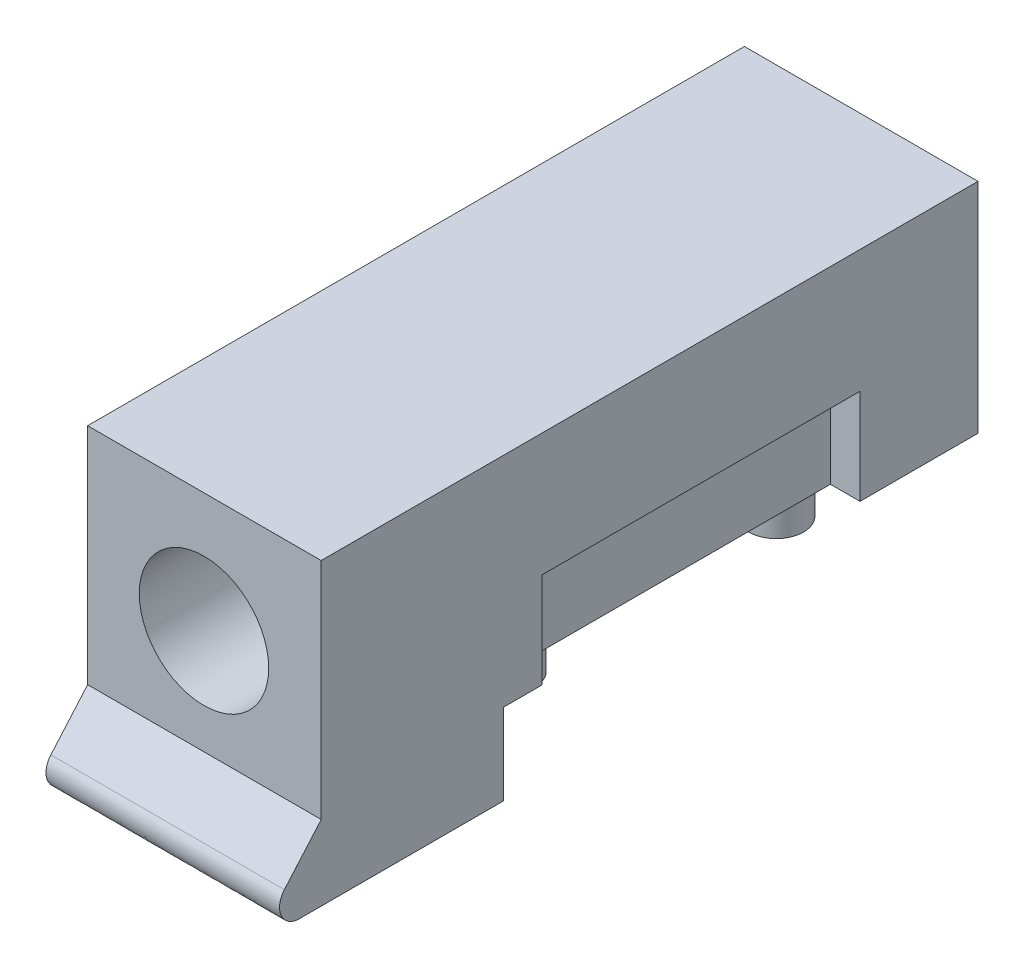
SolidWorks part; units mm, degrees
ref_plane "Front Plane" through (0, 0, 0) normal (0, 0, 1) x (1, 0, 0)
ref_plane "Top Plane" through (0, 0, 0) normal (0, 1, 0) x (1, 0, 0)
ref_plane "Right Plane" through (0, 0, 0) normal (1, 0, 0) x (0, 0, -1)
imported_body "Imported1"
sketch "Sketch1" plane through (0, 0, -31.68) normal (0, 0, 1) x (1, 0, 0)
  circle A0 centre (0, 5.9944) radius 4.041
extrude "Boss-Extrude1" add sketch "Sketch1" against normal up to surface (29.95 mm away)
sketch "Sketch2" plane through (-5.305, 0, 0) normal (-1, 0, 0) x (0, 0, 1)
  line L0 (-31.68, -0.2778) -> (-31.68, 11.2778) construction
  line L1 (-31.68, 7.4478) -> (-27.5359, 7.4478)
  line L2 (-31.68, 7.4478) -> (-31.68, 15.795)
  line L3 (-31.68, 15.795) -> (-27.5359, 15.795)
  line L4 (-27.5359, 7.4478) -> (-27.5359, 15.795)
extrude "Cut-Extrude1" cut sketch "Sketch2" against normal through all
sketch "Sketch3" plane through (-5.305, 0, 0) normal (-1, 0, 0) x (0, 0, 1)
  line L1 (-68.2273, 16.8697) -> (-28.6448, 16.8697)
  line L2 (-68.2273, 16.8697) -> (-68.2273, 9.95)
  line L3 (-68.2273, 9.95) -> (-28.6448, 9.95)
  line L4 (-28.6448, 16.8697) -> (-28.6448, 9.95)
  line L6 (-41.75, 0) -> (-40, 0) construction
  dimension "D1" = 9.95
extrude "Cut-Extrude2" cut sketch "Sketch3" against normal up to next
sketch "Sketch4" plane through (0, 0, -61.63) normal (0, 0, -1) x (-1, 0, 0)
  line L0 (5.305, 0) -> (-5.345, 0) construction
  circle A0 centre (0, 4.5) radius 2.95
  dimension "D1" = 5.9
  dimension "D2" = 4.5
extrude "Cut-Extrude3" cut sketch "Sketch4" against normal through all
sketch "Sketch5" plane through (3.995, 0, 0) normal (1, 0, 0) x (0, 0, -1)
  line L1 (61.63, 0) -> (42.8229, 0)
  line L2 (61.63, 0) -> (61.63, -4.1874)
  line L3 (61.63, -4.1874) -> (42.8229, -4.1874)
  line L4 (42.8229, 0) -> (42.8229, -4.1874)
extrude "Cut-Extrude4" cut sketch "Sketch5" against normal through all
sketch "Sketch6" plane through (0, 0, 0) normal (0, -1, 0) x (1, 0, 0)
  circle A0 centre (0, -45.4908) radius 3.3487
  circle A1 centre (0, -57.8044) radius 3.3947
  circle A2 centre (0, -51.1292) radius 2.1438
extrude "Boss-Extrude2" add sketch "Sketch6" against normal up to next
sketch "Sketch7" plane through (0, 0, 0) normal (0, -1, 0) x (1, 0, 0)
  line L0 (-5.305, -61.63) -> (-5.305, -56.25) construction
  line L1 (5.345, -40) -> (-5.305, -40) construction
  circle A0 centre (0.02, -45.5) radius 1.25
  circle A1 centre (0.02, -57.75) radius 1.25
  point P8 (0.02, -40)
  dimension "D1" = 12.25
  dimension "D2" = 2.5
  dimension "D3" = 2.5
  dimension "D4" = 5.325
  dimension "D5" = 5.5
extrude "Boss-Extrude3" add sketch "Sketch7" along normal blind 4
sketch "Sketch8" plane through (0, 0, 0) normal (0, -1, 0) x (1, 0, 0)
  circle A0 centre (0, -51.13) radius 1
  circle A1 centre (0.02, -45.5) radius 1.25 construction
  dimension "D1" = 5.63
  dimension "D2" = 2
extrude "Cut-Extrude5" cut sketch "Sketch8" against normal blind 4
sketch "Sketch9" plane through (0, 0, -31.68) normal (0, 0, 1) x (1, 0, 0)
  circle A0 centre (0, 4.5) radius 2.95
extrude "Cut-Extrude6" cut sketch "Sketch9" against normal through all
